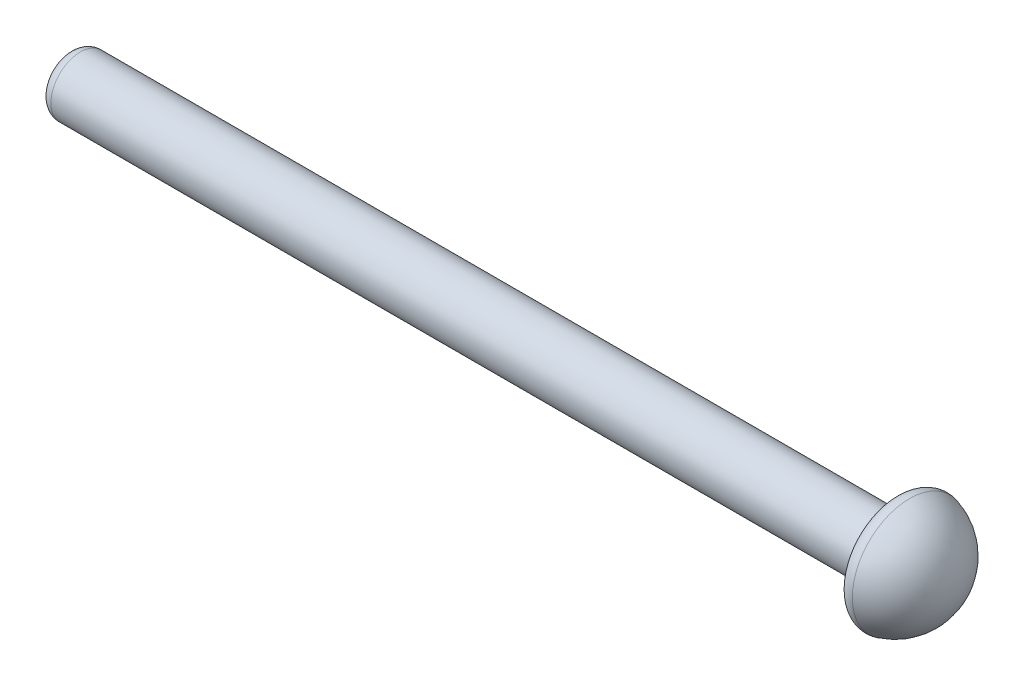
SolidWorks part; units mm, degrees
ref_plane "Спереди" through (0, 0, 0) normal (0, 0, 1) x (1, 0, 0)
ref_plane "Сверху" through (0, 0, 0) normal (0, 1, 0) x (1, 0, 0)
ref_plane "Справа" through (0, 0, 0) normal (1, 0, 0) x (0, 0, -1)
sketch "Эскиз1" plane through (0, 0, 0) normal (0, 0, 1) x (1, 0, 0)
  line L0 (-7.5, 0) -> (7.5, 0)
  line L1 (-7.5, 0) -> (-7.5, 0.5)
  line L2 (-7.5, 0.5) -> (6.5, 0.5)
  line L3 (6.5, 0.5) -> (6.5, 1)
  line L4 (6.5, 0) -> (6.5, 1) construction
  arc A0 (7.5, 0) -> (6.5, 1) centre (6.5, 0) ccw
  dimension "D3" = 1
  dimension "D1" = 0.5
  dimension "D2" = 14
revolve "Повернуть1" add sketch "Эскиз1" angle 360 about L0
fillet "Скругление1" radius 0.2 2 edges at (6.5, -1, 0) (-7.5, -0.5, 0)
